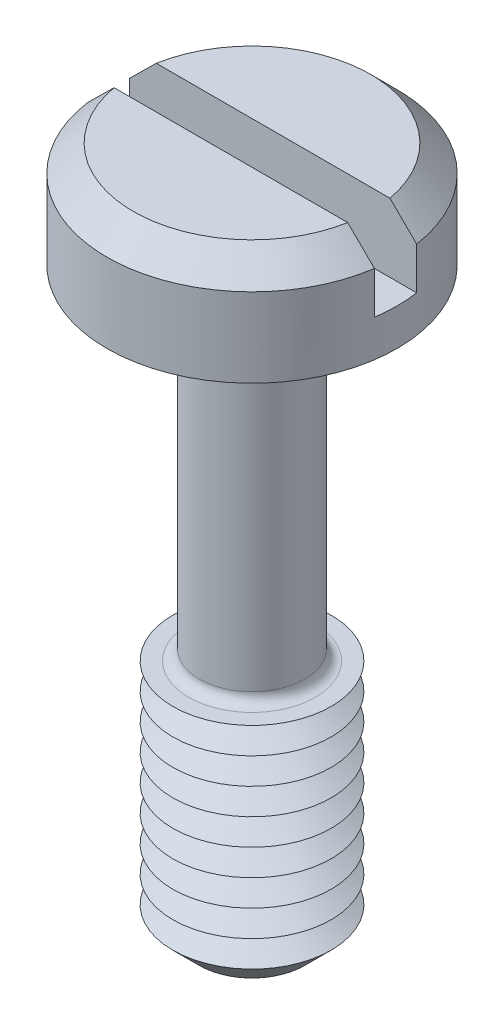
SolidWorks part; units mm, degrees
ref_plane "Front Plane" through (0, 0, 0) normal (0, 0, 1) x (1, 0, 0)
ref_plane "Top Plane" through (0, 0, 0) normal (0, 1, 0) x (1, 0, 0)
ref_plane "Right Plane" through (0, 0, 0) normal (1, 0, 0) x (0, 0, -1)
sketch "Sketch1" plane through (0, 0, 0) normal (0, 1, 0) x (1, 0, 0)
  circle A0 centre (0, 0) radius 2.75
  dimension "D1" = 5.5
extrude "Boss-Extrude1" add sketch "Sketch1" along normal blind 2
sketch "Sketch2" plane through (0, 0, 0) normal (0, -1, 0) x (1, 0, 0)
  circle A0 centre (0, 0) radius 1
  dimension "D1" = 2
extrude "Boss-Extrude2" add sketch "Sketch2" along normal blind 11
sketch "Sketch3" plane through (0, -11, 0) normal (0, -1, 0) x (1, 0, 0)
  circle A0 centre (0, 0) radius 1.5
  dimension "D1" = 3
extrude "Boss-Extrude3" add sketch "Sketch3" against normal blind 4.5
chamfer "Chamfer1" distance 0.5 angle 45 1 edges at (0, -11, -1.5)
sketch "Sketch4" plane through (0, 0, 0) normal (1, 0, 0) x (0, 0, -1)
  line L0 (0, -6.5871) -> (0, -12.0372) construction
sketch "Sketch5" plane through (0, 0, 0) normal (1, 0, 0) x (0, 0, -1)
  line L0 (-1.5, -6.5) -> (-1.067, -6.75)
  line L1 (-1.067, -6.75) -> (-1.5, -7)
  line L2 (-1.5, -6.5) -> (-1.5, -10.5) construction
  line L3 (-1.5, -7) -> (-1.5, -6.5)
  dimension "D1" = 0.5
revolve "Cut-Revolve1" cut sketch "Sketch5" angle 360 about L0
pattern_linear "LPattern1" count 8 spacing 0.5 along (0, -1, 0) of "Cut-Revolve1"
fillet "Fillet1" radius 0.2 2 edges at (0, -6.5, -1) (0, 0, -1)
chamfer "Chamfer2" distance 0.5 angle 45 1 edges at (0, 2, 2.75)
sketch "Sketch6" plane through (0, 2, 0) normal (0, 1, 0) x (1, 0, 0)
  line L1 (2.75, -0.4) -> (-2.75, -0.4)
  line L2 (2.75, -0.4) -> (2.75, 0.4)
  line L3 (2.75, 0.4) -> (-2.75, 0.4)
  line L4 (-2.75, -0.4) -> (-2.75, 0.4)
  line L5 (2.75, -0.4) -> (-2.75, 0.4) construction
  line L6 (2.75, 0.4) -> (-2.75, -0.4) construction
  circle A0 centre (0, 0) radius 2.75 construction
  point P0 (0, 0)
  dimension "D1" = 0.8
extrude "Cut-Extrude1" cut sketch "Sketch6" against normal blind 1.3
